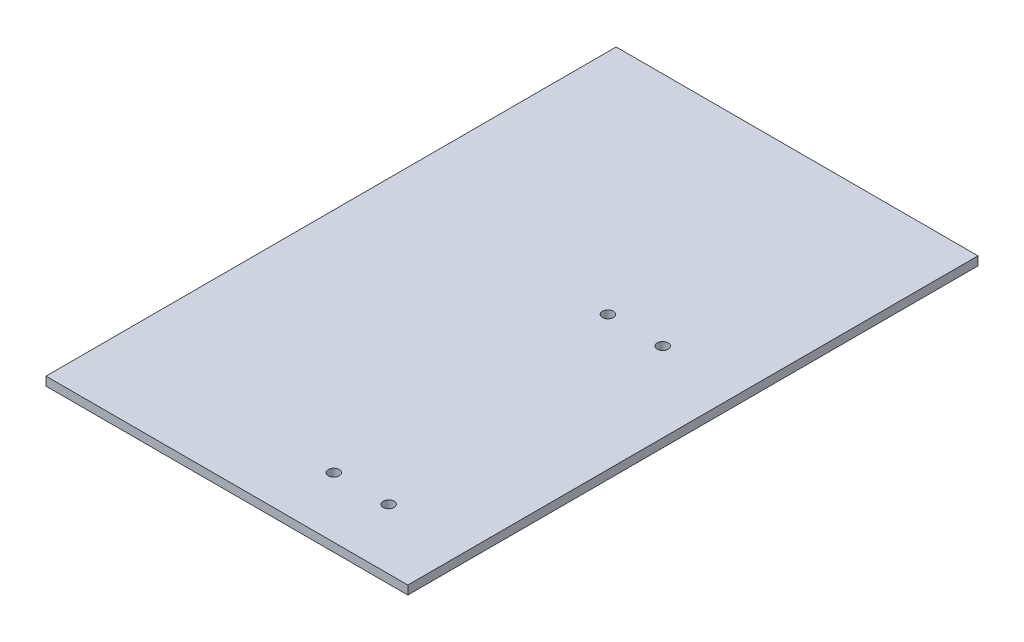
SolidWorks part; units mm, degrees
ref_plane "Plan de face" through (0, 0, 0) normal (0, 0, 1) x (1, 0, 0)
ref_plane "Plan de dessus" through (0, 0, 0) normal (0, 1, 0) x (1, 0, 0)
ref_plane "Plan de droite" through (0, 0, 0) normal (1, 0, 0) x (0, 0, -1)
sketch "Esquisse1" plane through (0, 0, 0) normal (0, 1, 0) x (1, 0, 0)
  line L1 (-33, -52) -> (33, -52)
  line L2 (-33, -52) -> (-33, 52)
  line L3 (-33, 52) -> (33, 52)
  line L4 (33, -52) -> (33, 52)
  line L5 (-33, -52) -> (33, 52) construction
  line L6 (-33, 52) -> (33, -52) construction
  point P0 (0, 0)
  dimension "D1" = 104
  dimension "D2" = 66
extrude "Boss.-Extru.1" add sketch "Esquisse1" along normal blind 1.5875
sketch "Esquisse2" plane through (-33, 0, 0) normal (-1, 0, 0) x (0, 0, 1)
  line L1 (-52, 0) -> (52, 0)
  line L2 (-52, 0) -> (-52, 4)
  line L3 (-52, 4) -> (52, 4)
  line L4 (52, 0) -> (52, 4)
  dimension "D1" = 4
  dimension "D2" = 104
extrude "Boss.-Extru.2" [suppressed] add sketch "Esquisse2" along normal blind 1.5875 contours L3 L4 L1 L2
sketch "Esquisse3" plane through (33, 0, 0) normal (1, 0, 0) x (0, 0, -1)
  line L1 (-52, 0) -> (52, 0)
  line L2 (-52, 0) -> (-52, 4)
  line L3 (-52, 4) -> (52, 4)
  line L4 (52, 0) -> (52, 4)
  dimension "D1" = 104
  dimension "D2" = 4
extrude "Boss.-Extru.3" [suppressed] add sketch "Esquisse3" along normal blind 1.5875
fillet "Congé2" [suppressed] radius 2
fillet "Congé3" [suppressed] radius 2
sketch "Esquisse4" plane through (0, 1.5875, 0) normal (0, 1, 0) x (1, 0, 0)
  line L1 (18.5, -41) -> (8.5, -41) construction
  line L2 (18.5, -41) -> (18.5, 9) construction
  line L3 (18.5, 9) -> (8.5, 9) construction
  line L4 (8.5, -41) -> (8.5, 9) construction
  line L5 (33, -52) -> (33, 52) construction
  line L6 (-33, -52) -> (33, -52) construction
  line L8 (18.5, -41) -> (8.5, 9) construction
  line L9 (8.5, -41) -> (18.5, 9) construction
  circle A0 centre (8.5, 9) radius 1
  circle A1 centre (18.5, 9) radius 1
  circle A2 centre (18.5, -41) radius 1
  circle A3 centre (8.5, -41) radius 1
  dimension "D5" = 2
  dimension "D1" = 50
  dimension "D2" = 10
  dimension "D3" = 14.5
  dimension "D4" = 11
extrude "Enlèv. mat.-Extru.1" cut sketch "Esquisse4" against normal blind 1.5875 contours A0 | A1 | A3 | A2
